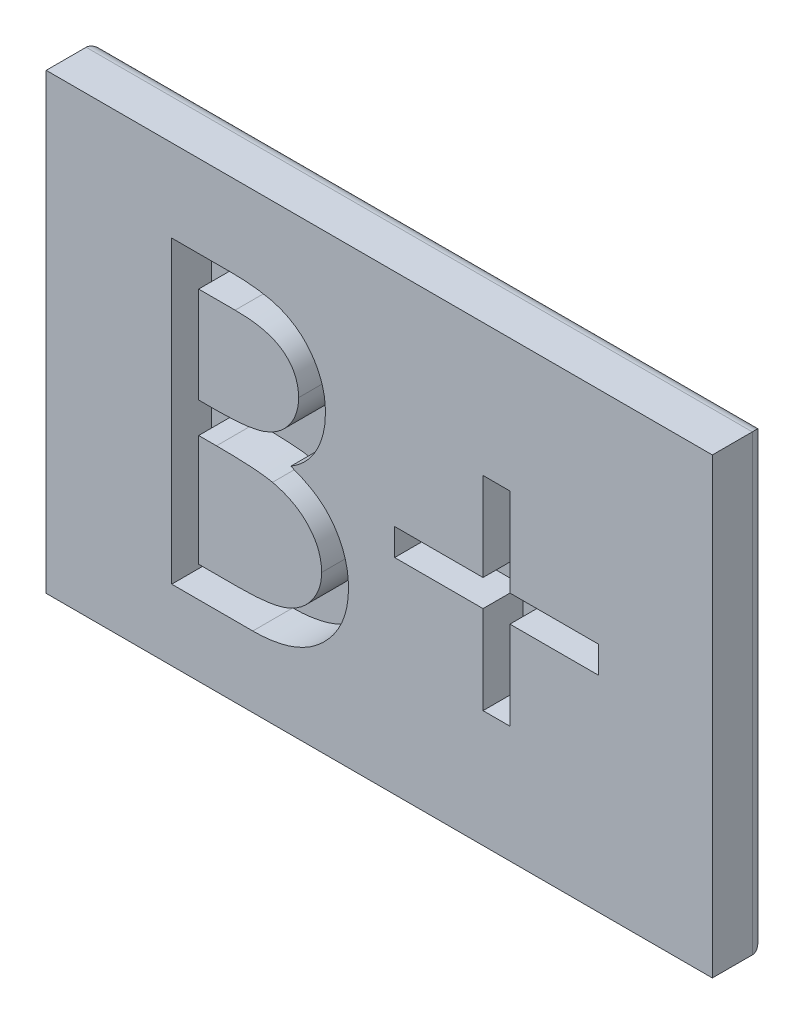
SolidWorks part; units mm, degrees
ref_plane "Front Plane" through (0, 0, 0) normal (0, 0, 1) x (1, 0, 0)
ref_plane "Top Plane" through (0, 0, 0) normal (0, 1, 0) x (1, 0, 0)
ref_plane "Right Plane" through (0, 0, 0) normal (1, 0, 0) x (0, 0, -1)
sketch "Sketch1" plane through (0, 0, 0) normal (0, 0, 1) x (1, 0, 0)
  line L1 (-15.875, -10.795) -> (15.875, -10.795)
  line L2 (-15.875, -10.795) -> (-15.875, 10.795)
  line L3 (-15.875, 10.795) -> (15.875, 10.795)
  line L4 (15.875, -10.795) -> (15.875, 10.795)
  line L5 (-15.875, -10.795) -> (15.875, 10.795) construction
  line L6 (-15.875, 10.795) -> (15.875, -10.795) construction
  point P0 (0, 0)
  dimension "D1" = 31.75
  dimension "D2" = 21.59
extrude "Boss-Extrude1" add sketch "Sketch1" along normal blind 2.54
fillet "Fillet1" radius 0.635 4 edges at (-15.875, 0, 0) (0, -10.795, 0) (0, 10.795, 0) (15.875, 0, 0)
sketch "Sketch2" plane through (0, 0, 2.54) normal (0, 0, 1) x (1, 0, 0)
  line L0 (-15.875, 10.795) -> (-14.977, 9.897) construction
  line L2 (-14.977, 9.897) -> (-14.977, 4.9485) construction
  line L3 (-14.977, 4.9485) -> (-14.977, 0) construction
  line L4 (-14.977, 0) -> (-14.977, -4.9485) construction
  line L5 (-14.977, -4.9485) -> (-14.977, -9.897) construction
  line L6 (-14.977, -9.897) -> (-15.875, -10.795) construction
  line L7 (15.875, 10.795) -> (-15.875, 10.795) construction
  line L8 (-15.875, -10.795) -> (15.875, -10.795) construction
  line L9 (-14.977, 4.9485) -> (14.977, 4.9485) construction
  line L10 (14.977, 4.9485) -> (14.977, 0) construction
  line L11 (14.977, 0) -> (-14.977, 0) construction
  line L12 (14.977, 0) -> (14.977, -4.9485) construction
  line L13 (14.977, -4.9485) -> (-14.977, -4.9485) construction
  line L14 (-14.977, -9.897) -> (14.977, -9.897) construction
  line L15 (14.977, -9.897) -> (14.977, -4.9485) construction
  line L16 (-14.977, 9.897) -> (14.977, 9.897) construction
  line L17 (14.977, 9.897) -> (14.977, 4.9485) construction
  line L18 (14.977, 9.897) -> (15.875, 10.795) construction
  line L19 (14.977, -9.897) -> (15.875, -10.795) construction
  line L20 (-14.977, -7.4227) -> (14.977, -7.4227) construction
  text T0 "B+" font "Century Gothic" height 14.2875
  dimension "D1" = 45
  dimension "D2" = 45
  dimension "D3" = 1.27
extrude "Cut-Extrude1" cut sketch "Sketch2" against normal blind 1.905
